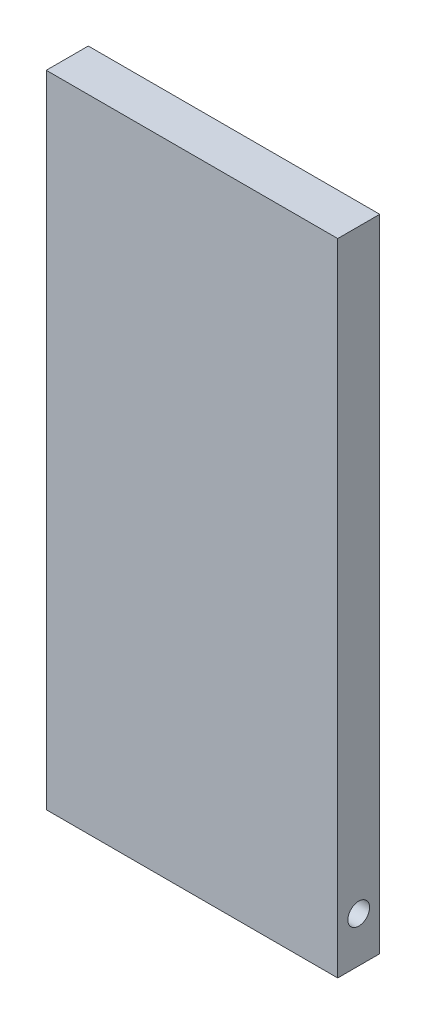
SolidWorks part; units mm, degrees
ref_plane "Front" through (0, 0, 0) normal (0, 0, 1) x (1, 0, 0)
ref_plane "Top" through (0, 0, 0) normal (0, 1, 0) x (1, 0, 0)
ref_plane "Right" through (0, 0, 0) normal (1, 0, 0) x (0, 0, -1)
sketch "Sketch1" plane through (0, 0, 0) normal (0, 0, 1) x (1, 0, 0)
  line L1 (-1.9761, 141.6303) -> (67.3847, 141.6303)
  line L2 (-1.9761, 141.6303) -> (-1.9761, -10.7697)
  line L3 (-1.9761, -10.7697) -> (67.3847, -10.7697)
  line L4 (67.3847, 141.6303) -> (67.3847, -10.7697)
  dimension "D1" = 152.4
extrude "Extrude1" add sketch "Sketch1" along normal mid plane 10
sketch "Sketch2" plane through (67.3847, 0, 0) normal (1, 0, 0) x (0, 0, -1)
  circle A0 centre (0, 0) radius 2.579
extrude "Cut-Extrude1" cut sketch "Sketch2" against normal through all
